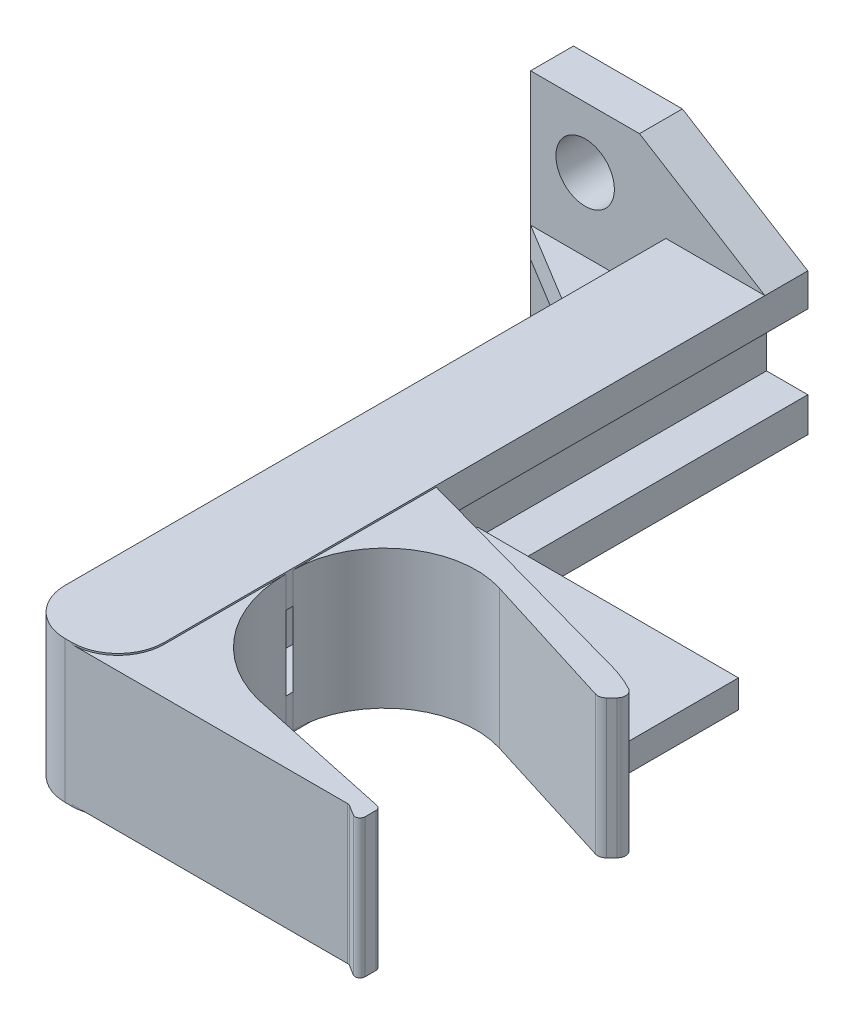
SolidWorks part; units mm, degrees
ref_plane "Front Plane" through (0, 0, 0) normal (0, 0, 1) x (1, 0, 0)
ref_plane "Top Plane" through (0, 0, 0) normal (0, 1, 0) x (1, 0, 0)
ref_plane "Right Plane" through (0, 0, 0) normal (1, 0, 0) x (0, 0, -1)
imported_body "101365578.stp"
sketch "Sketch1" plane through (0, 0, 0) normal (0, 0, -1) x (-1, 0, 0)
  line L10 (-18.034, 2.921) -> (-14.859, 2.921)
  line L11 (-14.859, 2.921) -> (-14.859, -2.794)
  line L12 (-14.859, -2.794) -> (-18.034, -2.794)
  line L13 (-18.034, -2.794) -> (-18.034, -5.461)
  line L14 (-18.034, -5.461) -> (-8.382, -11.43)
  line L15 (-8.382, -11.43) -> (0, -11.43)
  line L16 (0, -11.43) -> (0, 11.43)
  line L17 (0, 11.43) -> (-8.382, 11.43)
  line L18 (-8.382, 11.43) -> (-18.034, 5.461)
  line L19 (-18.034, 5.461) -> (-18.034, 2.921)
  line L20 (-18.034, 2.921) -> (-14.859, 2.921)
  line L21 (-14.859, 2.921) -> (-14.859, -2.794)
  line L22 (-14.859, -2.794) -> (-18.034, -2.794)
  line L23 (-18.034, -2.794) -> (-18.034, -5.461)
  line L24 (-18.034, -5.461) -> (-8.382, -11.43)
  line L25 (-8.382, -11.43) -> (0, -11.43)
  line L26 (0, -11.43) -> (0, 11.43)
  line L27 (0, 11.43) -> (-8.382, 11.43)
  line L28 (-8.382, 11.43) -> (-18.034, 5.461)
  line L29 (-18.034, 5.461) -> (-18.034, 2.921)
  dimension "D1" = 0
extrude "Boss-Extrude1" add sketch "Sketch1" along normal blind 25.4
sketch "Sketch4" plane through (0, 0, 3.302) normal (0, 0, 1) x (1, 0, 0)
  line L6 (0, 11.43) -> (0, 1.143)
  line L7 (0, 1.143) -> (10.414, 1.143)
  line L8 (10.414, 1.143) -> (10.414, 5.461)
  line L9 (10.414, 5.461) -> (18.034, 5.461)
  line L10 (18.034, 5.461) -> (8.382, 11.43)
  line L11 (8.382, 11.43) -> (0, 11.43)
  line L12 (0, 11.43) -> (0, 1.143)
  line L13 (0, 1.143) -> (10.414, 1.143)
  line L14 (10.414, 1.143) -> (10.414, 5.461)
  line L15 (10.414, 5.461) -> (18.034, 5.461)
  line L16 (18.034, 5.461) -> (8.382, 11.43)
  line L17 (8.382, 11.43) -> (0, 11.43)
  line L18 (10.414, -1.143) -> (0, -1.143)
  line L19 (0, -1.143) -> (0, -11.43)
  line L20 (0, -11.43) -> (8.382, -11.43)
  line L21 (8.382, -11.43) -> (18.034, -5.461)
  line L22 (18.034, -5.461) -> (10.414, -5.461)
  line L23 (10.414, -5.461) -> (10.414, -1.143)
  line L24 (10.414, -1.143) -> (0, -1.143)
  line L25 (0, -1.143) -> (0, -11.43)
  line L26 (0, -11.43) -> (8.382, -11.43)
  line L27 (8.382, -11.43) -> (18.034, -5.461)
  line L28 (18.034, -5.461) -> (10.414, -5.461)
  line L29 (10.414, -5.461) -> (10.414, -1.143)
  dimension "D1" = 0
  dimension "D2" = 0
extrude "Cut-Extrude4" cut sketch "Sketch4" against normal blind 25.4
sketch "Sketch5" plane through (0, -1.143, 0) normal (0, -1, 0) x (1, 0, 0)
  line L0 (10.414, 9.6091) -> (0, 3.302) construction
  line L1 (10.414, 9.6091) -> (0, 3.302)
  line L2 (10.414, -22.098) -> (10.414, 9.6091) construction
  line L3 (0, -22.098) -> (10.414, -15.7909)
  line L4 (0, 3.302) -> (0, -22.098)
  line L5 (10.414, 9.6091) -> (10.414, -15.7909)
extrude "Cut-Extrude5" cut sketch "Sketch5" against normal blind 25.4
hole_wizard "M4 Clearance Hole1" positions "Sketch8" profile "Sketch9" hole size "M4" standard "ANSI Metric"
sketch "Sketch8" plane through (0, 0, -22.098) normal (0, 0, 1) x (1, 0, 0)
  line L0 (0, 11.43) -> (0, 1.143) construction
  line L1 (4.2, 9.25) -> (4.2, 6.75) construction
  line L2 (4.2, 6.75) -> (4.2, -6.75) construction
  line L3 (4.2, -6.75) -> (4.2, -9.25) construction
  line L5 (0, 1.143) -> (0, -1.143) construction
  line L6 (0, 1.143) -> (0, -1.143) construction
  point P0 (4.2, 6.75)
  point P2 (4.2, -6.75)
  point P22 (0, 0)
  point P23 (4.2, 0)
  dimension "D1" = 4.2
  dimension "D2" = 2.5
  dimension "D3" = 13.5
sketch "Sketch9" plane through (4.2, 6.75, -22.098) normal (1, 0, 0) x (0, -1, 0)
  line L0 (0, 0) -> (0, 10.2419)
  line L1 (0, 10.2419) -> (2.25, 8.89)
  line L2 (2.25, 8.89) -> (2.25, 0)
  line L5 (2.25, 0) -> (0, 0)
  line L10 (0, 10.2419) -> (-2.25, 8.89) construction
  line L11 (0, -6.35) -> (0, 107.95) construction
  dimension "Hole Dia." = 4.5
  dimension "Hole Depth" = 8.89
  dimension "Drill Angle" = 118
